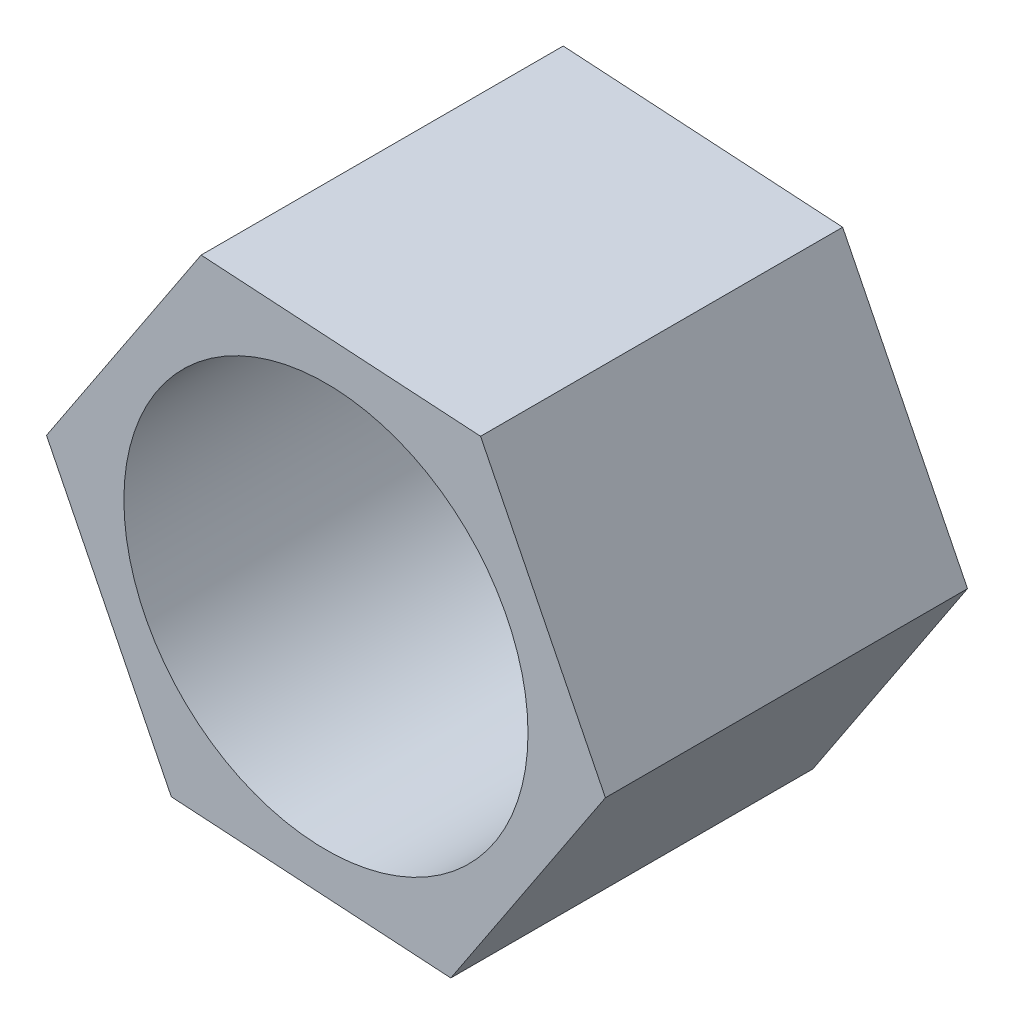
SolidWorks part; units mm, degrees
ref_plane "Alzado" through (0, 0, 0) normal (0, 0, 1) x (1, 0, 0)
ref_plane "Planta" through (0, 0, 0) normal (0, 1, 0) x (1, 0, 0)
ref_plane "Vista lateral" through (0, 0, 0) normal (1, 0, 0) x (0, 0, -1)
sketch "Croquis1" plane through (0, 0, 0) normal (0, 0, 1) x (1, 0, 0)
  line L1 (3.8261, 5.7759) -> (-3.089, 6.2015)
  line L2 (-3.089, 6.2015) -> (-6.9151, 0.4256)
  line L3 (-6.9151, 0.4256) -> (-3.8261, -5.7759)
  line L4 (-3.8261, -5.7759) -> (3.089, -6.2015)
  line L5 (3.089, -6.2015) -> (6.9151, -0.4256)
  line L6 (6.9151, -0.4256) -> (3.8261, 5.7759)
  circle A0 centre (0, 0) radius 6 construction
  dimension "D1" = 12
extrude "Saliente-Extruir1" add sketch "Croquis1" along normal blind 8.96
sketch "Croquis2" plane through (0, 0, 8.96) normal (0, 0, 1) x (1, 0, 0)
  circle A0 centre (0, 0) radius 5
  dimension "D1" = 10
extrude "Cortar-Extruir1" cut sketch "Croquis2" against normal blind 8.96 contours A0
